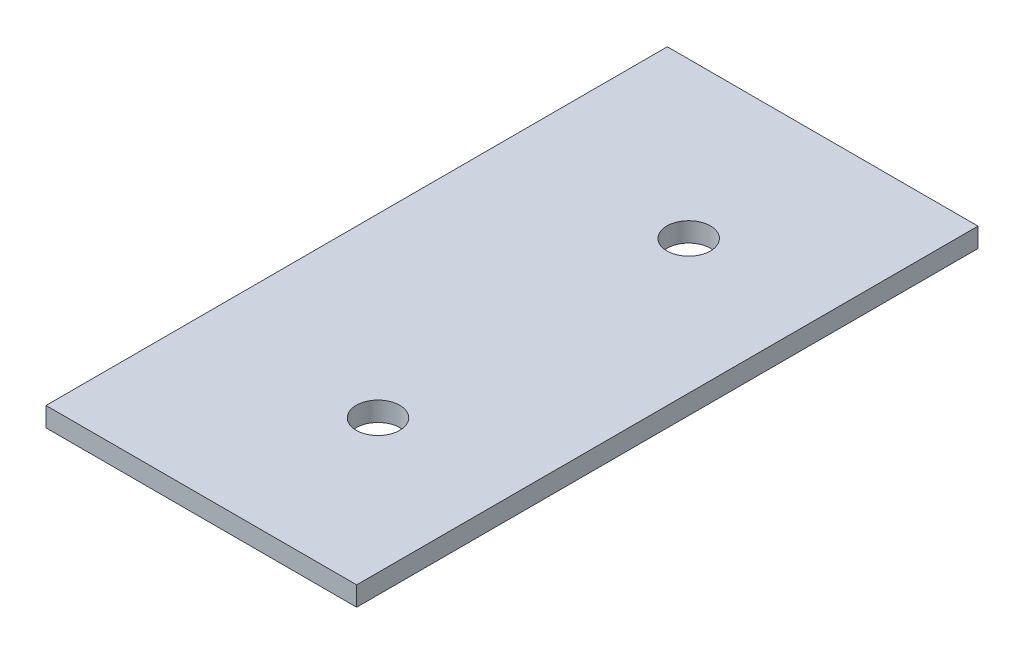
SolidWorks part; units mm, degrees
ref_plane "Front Plane" through (0, 0, 0) normal (0, 0, 1) x (1, 0, 0)
ref_plane "Top Plane" through (0, 0, 0) normal (0, 1, 0) x (1, 0, 0)
ref_plane "Right Plane" through (0, 0, 0) normal (1, 0, 0) x (0, 0, -1)
sketch "Sketch1" plane through (0, 0, 0) normal (0, 1, 0) x (1, 0, 0)
  line L1 (0, 0) -> (25.4, 0)
  line L2 (0, 0) -> (0, 50.8)
  line L3 (0, 50.8) -> (25.4, 50.8)
  line L4 (25.4, 0) -> (25.4, 50.8)
  dimension "D1" = 25.4
  dimension "D2" = 50.8
base flange "Base-Flange1" sketch "Sketch1" thickness 1.5875 reverse thickness direction no parameters "D1"=0.7366
sketch "Sketch2" plane through (0, 0, 0) normal (0, 1, 0) x (1, 0, 0)
  circle A0 centre (14.4462, 12.7) radius 1.778 construction
  circle A1 centre (14.4462, 38.1) radius 1.778 construction
  circle A2 centre (14.4462, 12.7) radius 1.778
  circle A3 centre (14.4462, 38.1) radius 1.778
extrude "Cut-Extrude1" cut sketch "Sketch2" against normal through all
sketch "Bend-Lines1" [suppressed] plane through (0, 0, 0) normal (0, 1, 0) x (1, 0, 0)
sketch "Bounding-Box1" [suppressed] plane through (0, 0, 0) normal (0, 1, 0) x (1, 0, 0)
sheet metal parameters "Sheet-Metal1" thickness 1.5875 parameters "D1"=0.7366
flat pattern "Flat-Pattern1"
sketch "Bend-Lines2" plane through (0, 0, 0) normal (0, 1, 0) x (1, 0, 0)
sketch3d "Bounding-Box2" [suppressed]
  line L0 (0, 0, 0) -> (0, 50.8, 0) construction
  line L1 (-25.4, 0, 0) -> (-25.4, 50.8, 0) construction
  line L2 (0, 0, 0) -> (-25.4, 0, 0) construction
  line L3 (0, 50.8, 0) -> (-25.4, 50.8, 0) construction
sheet metal parameters "Sheet-Metal2" thickness 1.5875 parameters "D1"=0.7366
flat pattern "Flat-Pattern1"
sketch "Bend-Lines2" plane through (0, 0, 0) normal (0, 1, 0) x (1, 0, 0)
sketch3d "Bounding-Box2" [suppressed]
  line L0 (0, 0, 0) -> (0, 50.8, 0) construction
  line L1 (25.4, 0, 0) -> (25.4, 50.8, 0) construction
  line L2 (0, 0, 0) -> (25.4, 0, 0) construction
  line L3 (0, 50.8, 0) -> (25.4, 50.8, 0) construction
